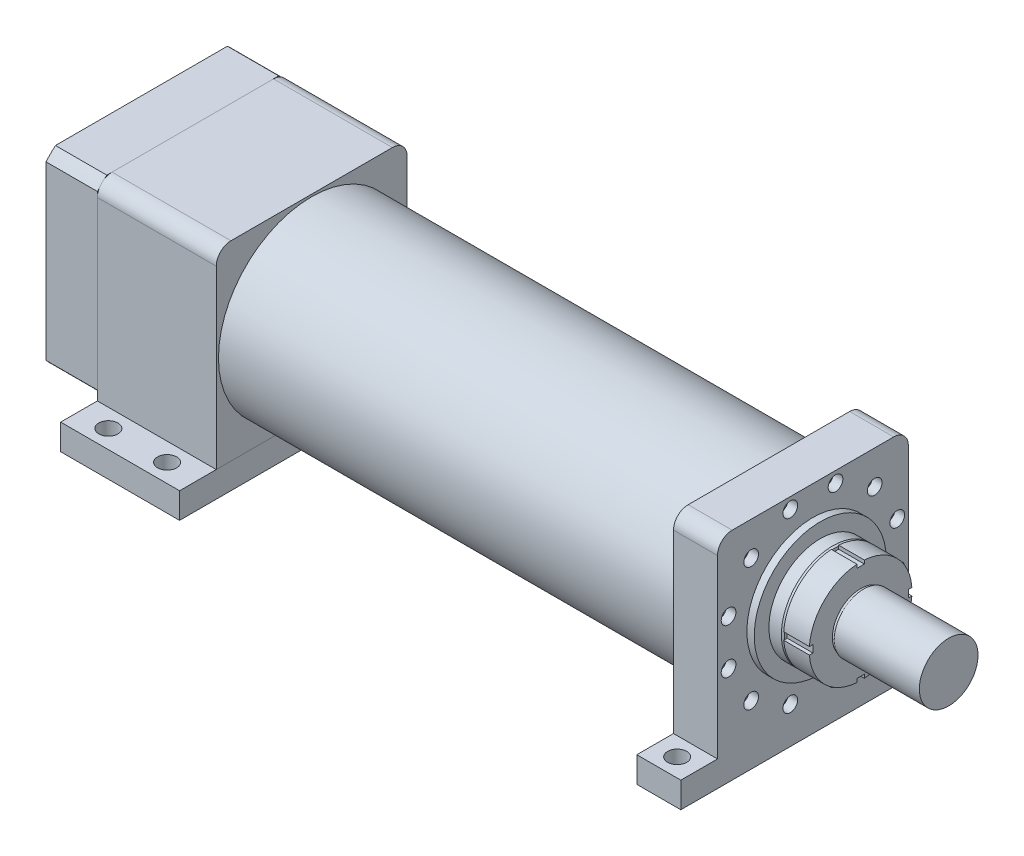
SolidWorks part; units mm, degrees
ref_plane "前视基准面" through (0, 0, 0) normal (0, 0, 1) x (1, 0, 0)
ref_plane "上视基准面" through (0, 0, 0) normal (0, 1, 0) x (1, 0, 0)
ref_plane "右视基准面" through (0, 0, 0) normal (1, 0, 0) x (0, 0, -1)
sketch "草图1" plane through (0, 0, 0) normal (1, 0, 0) x (0, 0, -1)
  circle A0 centre (0, 0) radius 127
  circle A1 centre (0, 0) radius 110
  dimension "D1" = 254
  dimension "D2" = 220
extrude "凸台-拉伸1" add sketch "草图1" along normal blind 623
sketch "草图2" plane through (623, 0, 0) normal (1, 0, 0) x (0, 0, -1)
  line L0 (0, 0) -> (30.7995, 114.9452) construction
  line L1 (-110, 130) -> (110, 130)
  line L2 (-130, 110) -> (-130, -110)
  line L3 (-110, -130) -> (110, -130)
  line L4 (130, 110) -> (130, -110)
  line L5 (-130, 130) -> (130, -130) construction
  line L6 (-130, -130) -> (130, 130) construction
  line L7 (0, 0) -> (0, 84.1033) construction
  line L8 (-130, -110) -> (-130, -130)
  line L9 (-130, -130) -> (-110, -130)
  line L10 (110, -130) -> (130, -130)
  line L11 (130, -130) -> (130, -110)
  circle A0 centre (0, 0) radius 135 construction
  arc A1 (130, 110) -> (110, 130) centre (110, 110) ccw
  arc A4 (-130, 110) -> (-110, 130) centre (-110, 110) cw
  circle A5 centre (30.7995, 114.9452) radius 6.5
  circle A6 centre (84.1457, 84.1457) radius 6.5
  circle A7 centre (114.9452, 30.7995) radius 6.5
  circle A8 centre (114.9452, -30.7995) radius 6.5
  circle A9 centre (84.1457, -84.1457) radius 6.5
  circle A10 centre (30.7995, -114.9452) radius 6.5
  circle A11 centre (-30.7995, -114.9452) radius 6.5
  circle A12 centre (-84.1457, -84.1457) radius 6.5
  circle A13 centre (-114.9452, -30.7995) radius 6.5
  circle A14 centre (-114.9452, 30.7995) radius 6.5
  circle A15 centre (-84.1457, 84.1457) radius 6.5
  circle A16 centre (-30.7995, 114.9452) radius 6.5
  point P0 (0, 0)
  point P47 (0, 0)
  dimension "D1" = 270
  dimension "D4" = 20
  dimension "D7" = 13
  dimension "D2" = 260
  dimension "D3" = 260
  dimension "D5" = 119
  dimension "D6" = 15
  dimension "D8" = 12
extrude "凸台-拉伸2" add sketch "草图2" along normal blind 60 separate body
sketch "草图3" plane through (683, 0, 0) normal (1, 0, 0) x (0, 0, -1)
  circle A0 centre (0, 0) radius 90
  dimension "D1" = 180
extrude "凸台-拉伸3" add sketch "草图3" along normal blind 10
sketch "草图5" plane through (693, 0, 0) normal (1, 0, 0) x (0, 0, -1)
  circle A0 centre (0, 0) radius 70
  dimension "D1" = 140
extrude "凸台-拉伸4" add sketch "草图5" along normal blind 20
chamfer "倒角1" distance 3 angle 20 1 edges at (713, 0, -70)
sketch "草图7" plane through (713, 0, 0) normal (1, 0, 0) x (0, 0, -1)
  circle A0 centre (0, 0) radius 70
  dimension "D1" = 140
extrude "凸台-拉伸5" add sketch "草图7" along normal blind 35
sketch "草图8" plane through (748, 0, 0) normal (1, 0, 0) x (0, 0, -1)
  circle A0 centre (0, 0) radius 38.5
  dimension "D1" = 77
extrude "凸台-拉伸6" add sketch "草图8" along normal blind 4
sketch "草图9" plane through (752, 0, 0) normal (1, 0, 0) x (0, 0, -1)
  circle A0 centre (0, 0) radius 40
  dimension "D1" = 80
extrude "凸台-拉伸7" add sketch "草图9" along normal blind 116
sketch "草图10" plane through (748, 0, 0) normal (1, 0, 0) x (0, 0, -1)
  line L0 (-5, -77.2193) -> (-5, -65)
  line L1 (5, -77.2193) -> (5, -65)
  line L2 (-76.4659, 5) -> (-65, 5)
  line L3 (98.9652, -5) -> (65, -5)
  line L4 (-65, 5) -> (-65, -5)
  line L5 (65, 5) -> (65, -5)
  line L6 (-5, 65) -> (5, 65)
  line L7 (-5, -65) -> (5, -65)
  line L8 (-76.4659, 5) -> (-79.4605, -5)
  line L9 (98.9652, 5) -> (98.9652, -5)
  line L10 (-5, 100.6875) -> (5, 100.6875)
  line L11 (-5, -77.2193) -> (5, -77.2193)
  line L12 (5, 65) -> (5, 100.6875)
  line L13 (-5, 65) -> (-5, 100.6875)
  line L15 (-65, -5) -> (-79.4605, -5)
  line L19 (65, 5) -> (98.9652, 5)
  dimension "D1" = 5
  dimension "D2" = 5
  dimension "D3" = 5
  dimension "D4" = 5
  dimension "D5" = 65
  dimension "D6" = 65
  dimension "D7" = 65
  dimension "D8" = 65
extrude "切除-拉伸2" cut sketch "草图10" against normal blind 35 contours L10 L12 L6 L13 | L19 L9 L3 L5 | L0 L7 L1 L11 | L8 L15 L4 L2
sketch "草图11" plane through (0, 0, 0) normal (-1, 0, 0) x (0, 0, 1)
  line L0 (130, -110) -> (130, -130)
  line L1 (-110, 130) -> (110, 130)
  line L2 (-130, 110) -> (-130, -110)
  line L3 (-110, -130) -> (110, -130)
  line L4 (130, 110) -> (130, -110)
  line L5 (-130, 130) -> (130, -130) construction
  line L6 (-130, -130) -> (130, 130) construction
  line L7 (130, -130) -> (110, -130)
  line L8 (-110, -130) -> (-130, -130)
  line L9 (-130, -130) -> (-130, -110)
  circle A0 centre (0, 0) radius 130 construction
  arc A3 (130, 110) -> (110, 130) centre (110, 110) ccw
  arc A4 (-130, 110) -> (-110, 130) centre (-110, 110) cw
  dimension "D1" = 260
  dimension "D2" = 260
  dimension "D3" = 260
extrude "凸台-拉伸8" add sketch "草图11" along normal blind 162 separate body
sketch "草图15" plane through (-162, 0, 0) normal (-1, 0, 0) x (0, 0, 1)
  line L1 (-117.1537, 130) -> (117.1537, 130)
  line L2 (-130, 117.1537) -> (-130, -117.1537)
  line L3 (-117.1537, -130) -> (117.1537, -130)
  line L4 (130, 117.1537) -> (130, -117.1537)
  line L5 (-123.7437, 123.7437) -> (123.7437, -123.7437) construction
  line L6 (-123.7437, -123.7437) -> (123.7437, 123.7437) construction
  arc A0 (117.1537, -130) -> (130, -117.1537) centre (0, 0) ccw
  arc A1 (-130, -117.1537) -> (-117.1537, -130) centre (0, 0) ccw
  arc A2 (130, 117.1537) -> (117.1537, 130) centre (0, 0) ccw
  arc A3 (-117.1537, 130) -> (-130, 117.1537) centre (0, 0) ccw
  point P0 (0, 0)
  dimension "D3" = 350
extrude "凸台-拉伸10" add sketch "草图15" along normal blind 70 separate body
sketch "草图16" plane through (-232, 0, 0) normal (-1, 0, 0) x (0, 0, 1)
  circle A0 centre (0, 0) radius 80
  dimension "D1" = 160
extrude "切除-拉伸4" cut sketch "草图16" against normal blind 26
sketch "草图17" plane through (-206, 0, 0) normal (-1, 0, 0) x (0, 0, 1)
  circle A0 centre (0, 0) radius 81.5
  dimension "D1" = 163
extrude "切除-拉伸5" cut sketch "草图17" against normal blind 38
sketch "草图18" plane through (0, -130, 0) normal (0, -1, 0) x (1, 0, 0)
  line L0 (-162, 130) -> (0, -130) construction
  line L1 (623, 130) -> (683, -130) construction
  line L6 (-162, 180) -> (0, 180)
  line L7 (-162, 180) -> (-162, -180)
  line L8 (-162, -180) -> (0, -180)
  line L9 (0, 180) -> (0, -180)
  line L10 (-162, 180) -> (0, -180) construction
  line L11 (-162, -180) -> (0, 180) construction
  line L12 (0, 127) -> (0, -127) construction
  line L13 (623, 180) -> (683, 180)
  line L14 (623, 180) -> (623, -180)
  line L15 (623, -180) -> (683, -180)
  line L16 (683, 180) -> (683, -180)
  line L17 (623, 180) -> (683, -180) construction
  line L18 (623, -180) -> (683, 180) construction
  line L19 (-162, -130) -> (-162, 130) construction
  circle A0 centre (-122, 155) radius 13
  circle A1 centre (-42, 155) radius 13
  circle A2 centre (-122, -155) radius 13
  circle A3 centre (-42, -155) radius 13
  circle A4 centre (653, 155) radius 13
  circle A5 centre (653, -155) radius 13
  point P4 (-81, 0)
  point P15 (653, 0)
  dimension "D3" = 26
  dimension "D4" = 26
  dimension "D5" = 26
  dimension "D6" = 26
  dimension "D11" = 26
  dimension "D12" = 26
  dimension "D1" = 360
  dimension "D2" = 360
  dimension "D7" = 80
  dimension "D8" = 80
  dimension "D9" = 40
  dimension "D10" = 40
  dimension "D13" = 25
  dimension "D14" = 25
  dimension "D15" = 25
  dimension "D16" = 25
  dimension "D17" = 25
extrude "凸台-拉伸11" add sketch "草图18" along normal blind 35
hole_wizard "孔1" positions "草图19" profile "草图20" legacy
sketch "草图19" plane through (683, 0, 0) normal (1, 0, 0) x (0, 0, -1)
  point P0 (-84.1457, 84.1457)
  point P3 (-30.7995, 114.9452)
  point P6 (30.7995, 114.9452)
  point P9 (84.1457, 84.1457)
  point P12 (114.9452, 30.7995)
  point P15 (114.9452, -30.7995)
  point P18 (84.1457, -84.1457)
  point P21 (30.7995, -114.9452)
  point P24 (-30.7995, -114.9452)
  point P27 (-84.1457, -84.1457)
  point P30 (-114.9452, -30.7995)
  point P33 (-114.9452, 30.7995)
sketch "草图20" plane through (683, 84.1457, 84.1457) normal (0, 1, 0) x (0, 0, -1)
  line L0 (0, 0) -> (0, 13)
  line L1 (0, 13) -> (10, 13)
  line L2 (10, 13) -> (10, 0)
  line L3 (10, 0) -> (0, 0)
  line L4 (0, 110) -> (0, -10) construction
  dimension "直径" = 20
  dimension "深度" = 13
